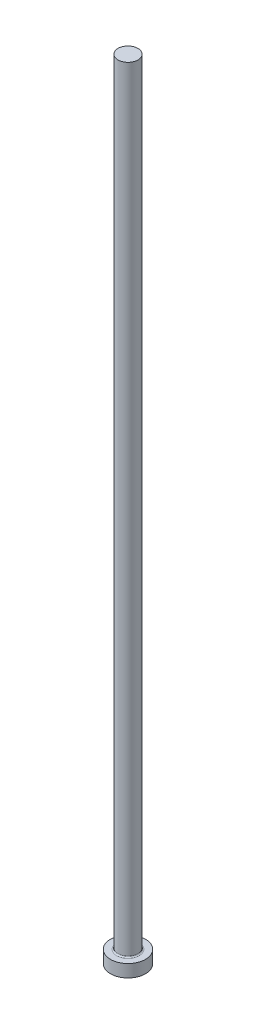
SolidWorks part; units mm, degrees
ref_plane "Plano frontal" through (0, 0, 0) normal (0, 0, 1) x (1, 0, 0)
ref_plane "Plano superior" through (0, 0, 0) normal (0, 1, 0) x (1, 0, 0)
ref_plane "Plano direito" through (0, 0, 0) normal (1, 0, 0) x (0, 0, -1)
sketch "Esboço1" plane through (0, 0, 0) normal (0, 0, 1) x (1, 0, 0)
  line L0 (0, 0) -> (7, 0)
  line L1 (7, 0) -> (7, 5)
  line L2 (7, 5) -> (4.5, 5)
  line L3 (4, 5.5) -> (4, 315)
  line L4 (4, 315) -> (0, 315)
  line L5 (0, 315) -> (0, 0) construction
  line L6 (0, 0) -> (0, 315)
  arc A0 (4.5, 5) -> (4, 5.5) centre (4.5, 5.5) cw
  dimension "D3" = 0.5
  dimension "D1" = 14
  dimension "D2" = 8
  dimension "D4" = 5
  dimension "D5" = 315
revolve "Revolução1" add sketch "Esboço1" angle 360 about L5
sketch "Esboço2"
  dimension "D1" = 0.525
  dimension "D2" = 1.225
  dimension "D3" = 0.7875
  dimension "D4" = 3.7625
wrap "Envolver1" sketch "Esboço2" wrap type deboss source sketch "Esboço2" thickness 0.1 parameters "D1"=0.1
